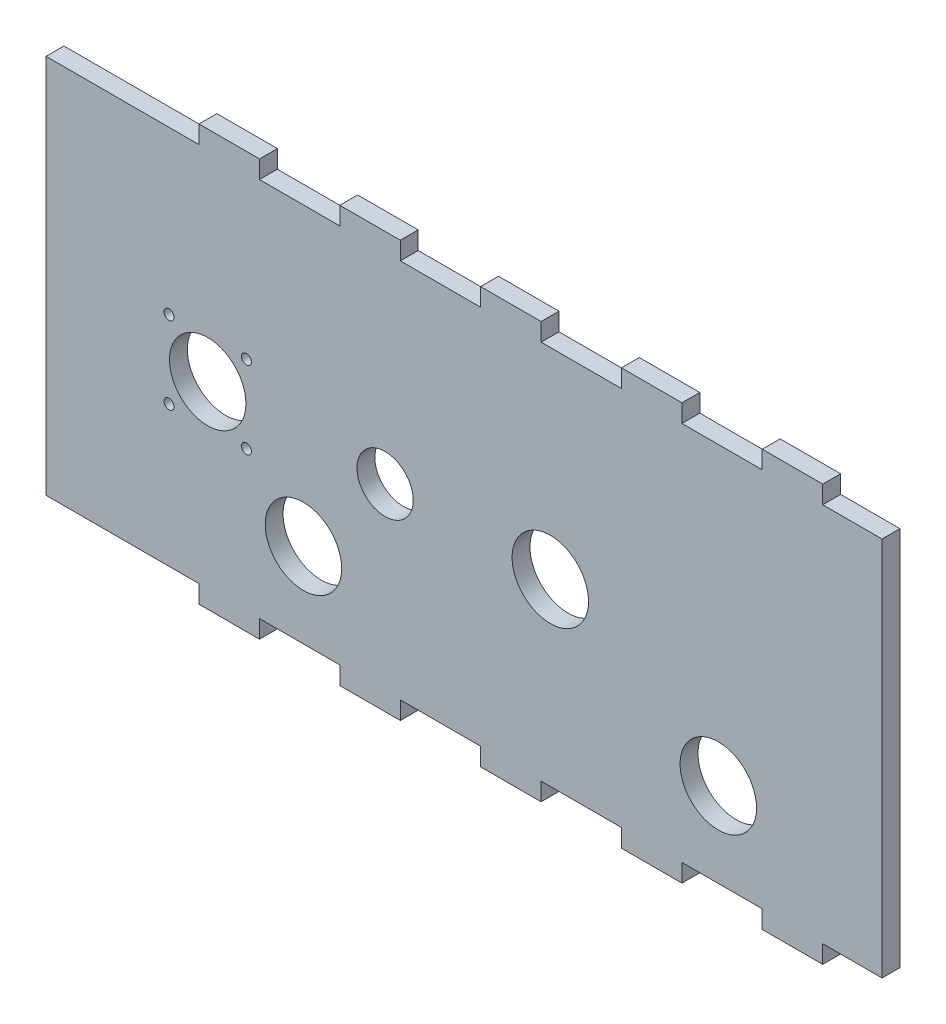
SolidWorks part; units mm, degrees
ref_plane "Front Plane" through (0, 0, 0) normal (0, 0, 1) x (1, 0, 0)
ref_plane "Top Plane" through (0, 0, 0) normal (0, 1, 0) x (1, 0, 0)
ref_plane "Right Plane" through (0, 0, 0) normal (1, 0, 0) x (0, 0, -1)
sketch "Sketch1" plane through (0, 0, 0) normal (0, 0, 1) x (1, 0, 0)
  line L0 (179.0489, 63.6704) -> (179.0489, 30) construction
  line L1 (0, 0) -> (296.845, 0) construction
  line L5 (91.3825, 30) -> (238.7025, 30) construction
  line L6 (179.0489, 63.6704) -> (179.0489, 30) construction
  line L7 (165.0425, 30) -> (165.0425, 0) construction
  line L8 (0, 0) -> (54.3, 0)
  line L9 (54.3, 0) -> (54.3, -6.35)
  line L10 (43.6401, 77.4192) -> (71.1376, 49.9216) construction
  line L11 (43.6401, 49.9216) -> (71.1376, 77.4192) construction
  line L12 (54.3, -6.35) -> (75.785, -6.35)
  line L13 (75.785, -6.35) -> (75.785, 0)
  line L18 (296.845, 0) -> (296.845, 135)
  line L19 (296.845, 135) -> (0, 135) construction
  line L20 (0, 135) -> (0, 0)
  line L21 (75.785, 0) -> (104.3, 0)
  line L22 (104.3, 0) -> (104.3, -6.35)
  line L23 (104.3, -6.35) -> (125.785, -6.35)
  line L24 (125.785, -6.35) -> (125.785, 0)
  line L25 (125.785, 0) -> (154.3, 0)
  line L26 (154.3, 0) -> (154.3, -6.35)
  line L27 (154.3, -6.35) -> (175.785, -6.35)
  line L28 (175.785, -6.35) -> (175.785, 0)
  line L29 (175.785, 0) -> (204.3, 0)
  line L30 (204.3, 0) -> (204.3, -6.35)
  line L31 (204.3, -6.35) -> (225.785, -6.35)
  line L32 (225.785, -6.35) -> (225.785, 0)
  line L33 (225.785, 0) -> (254.3, 0)
  line L34 (254.3, 0) -> (254.3, -6.35)
  line L35 (254.3, -6.35) -> (275.785, -6.35)
  line L36 (275.785, -6.35) -> (275.785, 0)
  line L37 (275.785, 0) -> (296.845, 0)
  line L38 (0, 67.5) -> (296.845, 67.5) construction
  line L39 (275.785, 135) -> (296.845, 135)
  line L40 (275.785, 141.35) -> (275.785, 135)
  line L41 (254.3, 141.35) -> (275.785, 141.35)
  line L42 (254.3, 135) -> (254.3, 141.35)
  line L43 (225.785, 135) -> (254.3, 135)
  line L44 (225.785, 141.35) -> (225.785, 135)
  line L45 (204.3, 141.35) -> (225.785, 141.35)
  line L46 (204.3, 135) -> (204.3, 141.35)
  line L47 (175.785, 135) -> (204.3, 135)
  line L48 (175.785, 141.35) -> (175.785, 135)
  line L49 (154.3, 141.35) -> (175.785, 141.35)
  line L50 (154.3, 135) -> (154.3, 141.35)
  line L51 (125.785, 135) -> (154.3, 135)
  line L52 (125.785, 141.35) -> (125.785, 135)
  line L53 (104.3, 141.35) -> (125.785, 141.35)
  line L54 (104.3, 135) -> (104.3, 141.35)
  line L55 (75.785, 135) -> (104.3, 135)
  line L56 (75.785, 141.35) -> (75.785, 135)
  line L57 (54.3, 141.35) -> (75.785, 141.35)
  line L58 (54.3, 135) -> (54.3, 141.35)
  line L59 (0, 135) -> (54.3, 135)
  circle A0 centre (91.3825, 30) radius 13.575
  circle A1 centre (238.7025, 30) radius 13.575
  circle A2 centre (179.0489, 63.6704) radius 13.575
  circle A3 centre (57.3889, 63.6704) radius 13.575
  circle A4 centre (57.3889, 63.6704) radius 19.4437 construction
  circle A5 centre (43.6401, 77.4192) radius 1.778
  circle A6 centre (43.6401, 49.9216) radius 1.778
  circle A7 centre (71.1376, 77.4192) radius 1.778
  circle A8 centre (71.1376, 49.9216) radius 1.778
  circle A9 centre (57.3889, 63.6704) radius 30.48 construction
  circle A10 centre (120.3889, 63.6704) radius 10
  point P2 (165.0425, -6.35)
  point P71 (0, 0)
  point P72 (57.3889, 63.6704)
  point P73 (0, 0)
  dimension "D2" = 27.15
  dimension "D3" = 147.32
  dimension "D4" = 121.66
  dimension "D9" = 38.8874
  dimension "D10" = 3.556
  dimension "D13" = 60.96
  dimension "D19" = 20
  dimension "D5" = 30
  dimension "D6" = 68.5
  dimension "D7" = 93.91
  dimension "D8" = 21.485
  dimension "D11" = 28.515
  dimension "D12" = 6.35
  dimension "D14" = 54.3
  dimension "D15" = 21.06
  dimension "D16" = 135
  dimension "D17" = 296.845
  dimension "D18" = 147.7
  dimension "D20" = 63
extrude "Boss-Extrude1" add sketch "Sketch1" along normal blind 6.35
